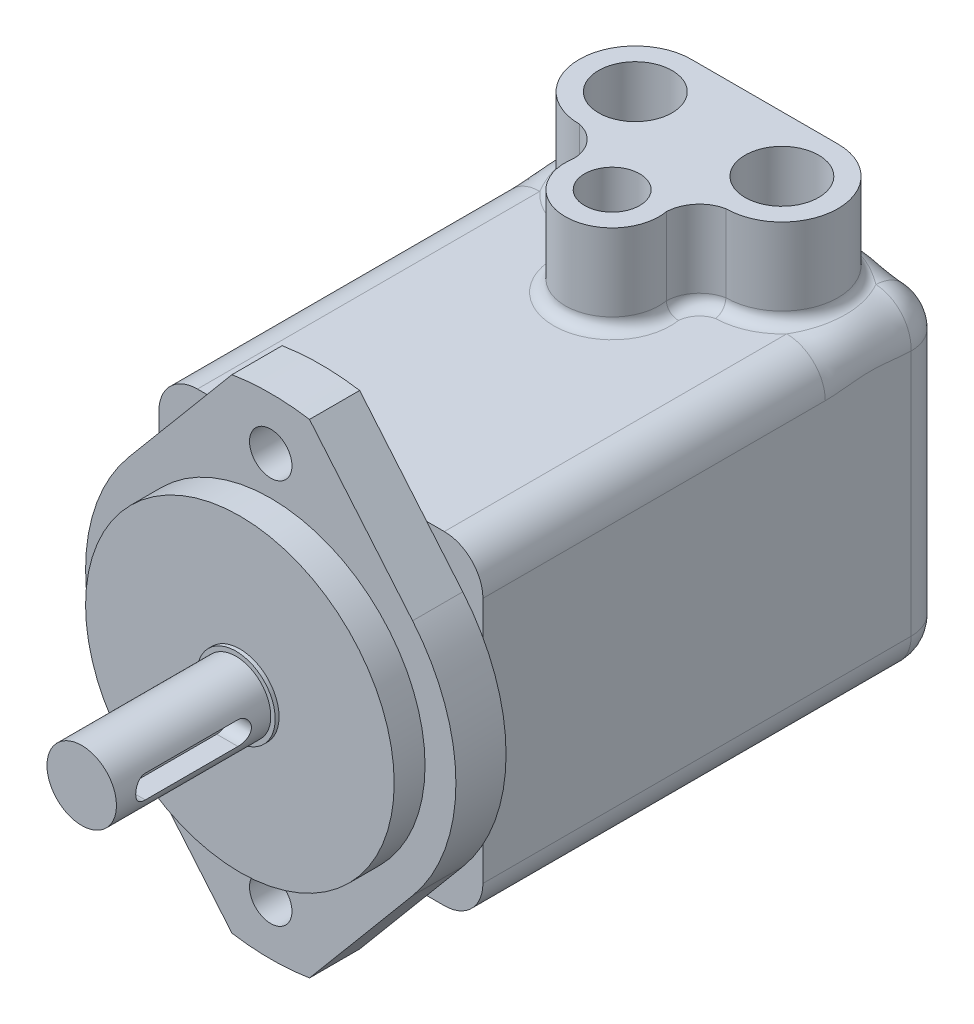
SolidWorks part; units mm, degrees
ref_plane "Front Plane" through (0, 0, 0) normal (0, 0, 1) x (1, 0, 0)
ref_plane "Top Plane" through (0, 0, 0) normal (0, 1, 0) x (1, 0, 0)
ref_plane "Right Plane" through (0, 0, 0) normal (1, 0, 0) x (0, 0, -1)
sketch "Sketch1" plane through (0, 0, 0) normal (0, 0, 1) x (1, 0, 0)
  line L0 (0, -50) -> (0, 50) construction
  line L1 (48, 0) -> (-48, 0) construction
  line L2 (0, -63.5) -> (0, 63.5) construction
  line L3 (-48, -23.2387) -> (-48, 23.2387) construction
  line L4 (48, -23.2387) -> (48, 23.2387) construction
  line L5 (-36.7701, 30.8538) -> (-10.048, 62.7)
  line L6 (36.7701, 30.8538) -> (10.048, 62.7)
  line L7 (36.7701, -30.8538) -> (10.048, -62.7)
  line L8 (-36.7701, -30.8538) -> (-10.048, -62.7)
  circle A4 centre (0, 0) radius 40 construction
  circle A5 centre (0, 50) radius 5.5
  circle A6 centre (0, -50) radius 5.5
  circle A7 centre (0, 0) radius 63.5 construction
  arc A8 (-36.7701, 30.8538) -> (-36.7701, -30.8538) centre (0, 0) ccw
  arc A9 (10.048, -62.7) -> (-10.048, -62.7) centre (0, 0) cw
  arc A10 (10.048, 62.7) -> (-10.048, 62.7) centre (0, 0) ccw
  arc A11 (36.7701, -30.8538) -> (36.7701, 30.8538) centre (0, 0) ccw
  circle A12 centre (0, 0) radius 9
  point P6 (0, 0)
  point P11 (0, 0)
  point P13 (0, 0)
  point P18 (-48, 0)
  point P22 (48, 0)
  dimension "D2" = 100
  dimension "D3" = 11
  dimension "D4" = 96
  dimension "D1" = 80
  dimension "D5" = 127
  dimension "D6" = 40
  dimension "D7" = 18
extrude "Boss-Extrude1" add sketch "Sketch1" along normal blind 13
sketch "Sketch2" plane through (0, 0, 13) normal (0, 0, 1) x (1, 0, 0)
  circle A0 centre (0, 0) radius 40
  circle A1 centre (0, 0) radius 9
  dimension "D1" = 80
extrude "Boss-Extrude2" add sketch "Sketch2" along normal blind 8
sketch "Sketch3" plane through (0, 0, 21) normal (0, 0, 1) x (1, 0, 0)
  circle A0 centre (0, 0) radius 10.15
  circle A2 centre (0, 0) radius 9
  dimension "D1" = 20.3
  dimension "D2" = 18
extrude "Boss-Extrude3" add sketch "Sketch3" along normal blind 1
sketch "Sketch4" plane through (0, 0, 0) normal (0, 0, -1) x (-1, 0, 0)
  circle A0 centre (0, 0) radius 9
  dimension "D1" = 18
extrude "Boss-Extrude4" add sketch "Sketch4" against normal blind 62 separate body
ref_plane "Plane1" through (9, 0, 0) normal (1, 0, 0) x (0, 0, -1)
sketch "Sketch5" plane through (9, 0, 0) normal (1, 0, 0) x (0, 0, -1)
  line L0 (-62, 0) -> (0, 0) construction
  line L1 (-62, 9) -> (-62, -9) construction
  line L2 (-54, 0) -> (-30, 0) construction
  line L3 (-54, 3) -> (-30, 3)
  line L4 (-54, -3) -> (-30, -3)
  arc A0 (-54, 3) -> (-54, -3) centre (-54, 0) ccw
  arc A1 (-30, -3) -> (-30, 3) centre (-30, 0) ccw
  point P7 (-42, 0)
  point P12 (-57, 0)
  point P13 (-27, 0)
  dimension "D1" = 5
  dimension "D2" = 30
  dimension "D3" = 6
extrude "Cut-Extrude1" cut sketch "Sketch5" against normal blind 6
ref_plane "Plane2" through (0, 0, -121) normal (0, 0, 1) x (1, 0, 0)
sketch "Sketch7" plane through (0, 0, -121) normal (0, 0, 1) x (1, 0, 0)
  line L0 (-64.5575, 0) -> (64.5575, 0) construction
  line L1 (0, -74.7606) -> (0, 74.7606) construction
  line L3 (-42, -42) -> (42, -42)
  line L4 (-42, -42) -> (-42, 42)
  line L5 (-42, 42) -> (42, 42)
  line L6 (42, -42) -> (42, 42)
  line L7 (-42, -42) -> (42, 42) construction
  line L8 (-42, 42) -> (42, -42) construction
  point P0 (0, 0)
  point P6 (0, 0)
  point P10 (0, 0)
  point P11 (0, 0)
  dimension "D1" = 84
  dimension "D2" = 84
extrude "Boss-Extrude7" add sketch "Sketch7" along normal up to surface (121 mm away) separate body
ref_plane "Plane3" through (0, 65, 0) normal (0, 1, 0) x (1, 0, 0)
sketch "Sketch9" plane through (0, 65, 0) normal (0, 1, 0) x (1, 0, 0)
  line L0 (-19, 100.5) -> (19, 100.5) construction
  line L1 (0, 100.5) -> (0, 75.5) construction
  line L2 (-10.048, -13) -> (-36.7701, -13) construction
  line L3 (-19, 115.025) -> (19, 115.025)
  line L4 (0, 0) -> (0, 162.462) construction
  circle A0 centre (-19, 100.5) radius 9.525
  circle A1 centre (19, 100.5) radius 9.525
  circle A2 centre (0, 75.5) radius 7.1438
  arc A3 (-19, 115.025) -> (-19, 85.975) centre (-19, 100.5) ccw
  arc A4 (19, 85.975) -> (19, 115.025) centre (19, 100.5) ccw
  arc A5 (-11.9615, 77.596) -> (11.9615, 77.596) centre (0, 75.5) ccw
  arc A6 (-11.9615, 77.596) -> (-19, 85.975) centre (-20.8094, 77.3094) ccw
  arc A7 (11.9615, 77.596) -> (19, 85.975) centre (20.8094, 77.3094) cw
  circle A9 centre (-19, 100.5) radius 14.525 construction
  circle A10 centre (19, 100.5) radius 14.525 construction
  circle A11 centre (0, 75.5) radius 12.1438 construction
  point P10 (159.5707, 100.5)
  point P12 (138.1895, 75.5)
  point P23 (121.5707, 100.5)
  dimension "D1" = 19.05
  dimension "D2" = 14.2875
  dimension "D7" = 8.8525
  dimension "D8" = 11.9615
  dimension "D3" = 25
  dimension "D4" = 38
  dimension "D5" = 113.5
  dimension "D6" = 5
extrude "Boss-Extrude8" add sketch "Sketch9" against normal up to body separate body
fillet "Fillet1" radius 3 6 edges at (-33.525, 42, -100.5) (0, 42, -115.025) (0, 42, -63.3563) (33.525, 42, -100.5) (14.031, 42, -83.0033) (-14.031, 42, -83.0033)
ref_plane "Plane4" through (0, 0, -30) normal (0, 0, -1) x (-1, 0, 0)
sketch "Sketch12" plane through (0, 0, 0) normal (0, 0, -1) x (-1, 0, 0)
  line L0 (-23.2379, -42) -> (23.2379, -42)
  line L1 (42, -42) -> (-42, -42) construction
  line L2 (-23.2379, 42) -> (23.2379, 42)
  line L3 (-42, 42) -> (42, 42) construction
  arc A9 (-23.2379, 42) -> (-23.2379, -42) centre (0, 0) ccw
  arc A12 (23.2379, -42) -> (23.2379, 42) centre (0, 0) ccw
fillet "Fillet2" radius 10 4 edges at (-42, 42, -60.5) (42, 42, -60.5) (42, -42, -60.5) (-42, -42, -60.5)
fillet "Fillet3" radius 10 8 edges at (-39.0711, 39.0711, -121) (0, 42, -121) (39.0711, 39.0711, -121) (42, 0, -121) (39.0711, -39.0711, -121) (0, -42, -121) (-39.0711, -39.0711, -121) (-42, 0, -121)
sketch "Sketch13" plane through (0, 0, -30) normal (0, 0, -1) x (-1, 0, 0)
  line L0 (-42, -32) -> (-42, 32.0255) construction
  line L1 (32, -42) -> (-32, -42)
  line L2 (42, -32) -> (42, 32)
  line L3 (32, 42) -> (-32, 42)
  line L4 (-42, -32) -> (-42, 32)
  line L5 (42, -42) -> (-42, 42) construction
  line L6 (42, 42) -> (-42, -42) construction
  line L7 (32, -42) -> (-32, -42) construction
  arc A0 (-42, 32) -> (-32, 42) centre (-32, 32) cw
  arc A1 (32, 42) -> (42, 32) centre (32, 32) cw
  arc A2 (42, -32) -> (32, -42) centre (32, -32) cw
  arc A3 (-32, -42) -> (-42, -32) centre (-32, -32) cw
  point P0 (0, 0)
  dimension "D1" = 10
